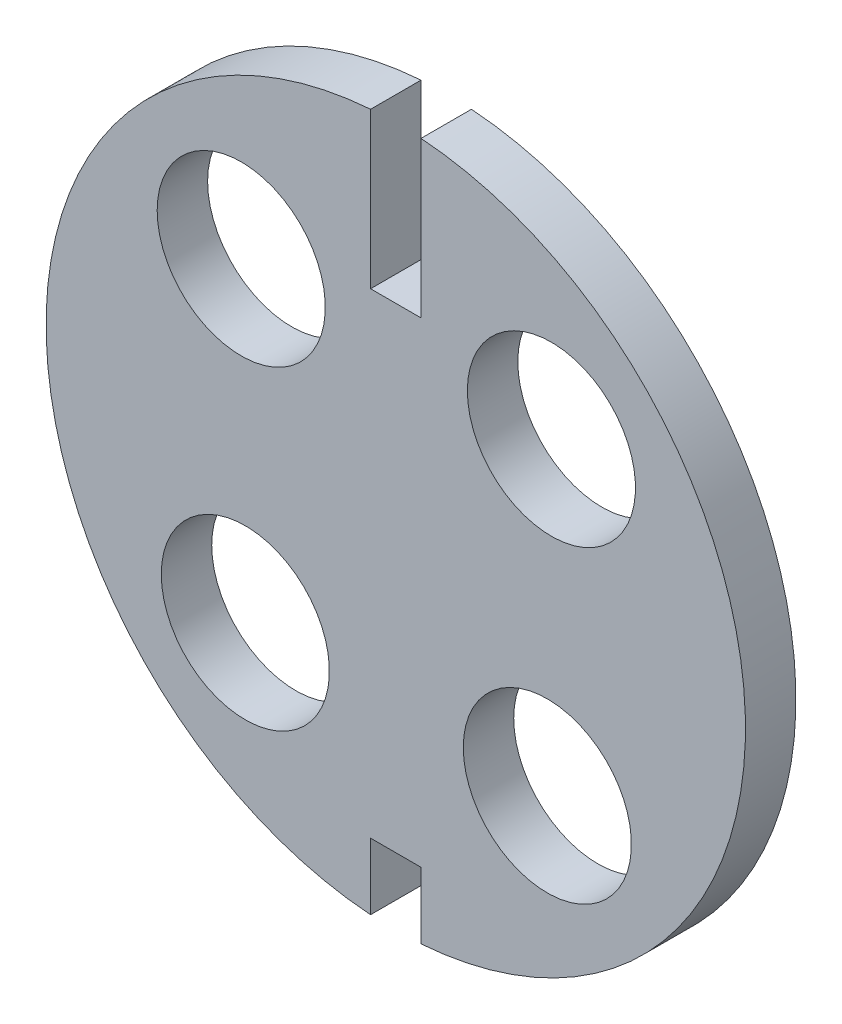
SolidWorks part; units mm, degrees
ref_plane "Front Plane" through (0, 0, 0) normal (0, 0, 1) x (1, 0, 0)
ref_plane "Top Plane" through (0, 0, 0) normal (0, 1, 0) x (1, 0, 0)
ref_plane "Right Plane" through (0, 0, 0) normal (1, 0, 0) x (0, 0, -1)
sketch "Sketch1" plane through (0, 0, 0) normal (0, 0, 1) x (1, 0, 0)
  circle A0 centre (0, 0) radius 26.416
  dimension "D1" = 52.832
extrude "Extrude1" add sketch "Sketch1" along normal blind 3.81
sketch "Sketch2" plane through (0, 0, 0) normal (0, 0, 1) x (1, 0, 0)
  line L0 (0, 0) -> (0, 27.8395) construction
  line L1 (0, 0) -> (0, -28.8472) construction
  line L2 (0, 0) -> (-23.3487, 23.3487) construction
  line L3 (0, 0) -> (-29.645, 0) construction
  line L4 (0, 0) -> (31.2407, 0) construction
  circle A0 centre (-11.6743, 11.6743) radius 6.35
  circle A1 centre (11.7569, 11.5912) radius 6.35
  circle A2 centre (11.4489, -11.8955) radius 6.35
  circle A3 centre (-11.3643, -11.9764) radius 6.35
  dimension "D2" = 12.7
  dimension "D4" = 12.7
  dimension "D5" = 12.7
  dimension "D6" = 12.7
  dimension "D1" = 45
  dimension "D3" = 16.51
  dimension "D7" = 16.51
  dimension "D8" = 16.51
  dimension "D9" = 16.51
extrude "Cut-Extrude1" cut sketch "Sketch2" along normal through all
sketch "Sketch3" plane through (0, 0, 0) normal (0, 0, 1) x (1, 0, 0)
  line L0 (0, 0) -> (0, 27.4196) construction
  line L1 (0, 0) -> (0, -27.9234) construction
  line L2 (-30.4848, 0) -> (29.645, 0) construction
  line L4 (-1.905, 27.4196) -> (1.905, 27.4196)
  line L5 (-1.905, 27.4196) -> (-1.905, 14.605)
  line L6 (-1.905, 14.605) -> (1.905, 14.605)
  line L7 (1.905, 27.4196) -> (1.905, 14.605)
  line L8 (1.905, -27.9234) -> (-1.905, -27.9234)
  line L9 (1.905, -27.9234) -> (1.905, -21.336)
  line L10 (1.905, -21.336) -> (-1.905, -21.336)
  line L11 (-1.905, -27.9234) -> (-1.905, -21.336)
  dimension "D1" = 3.81
  dimension "D2" = 3.81
  dimension "D3" = 1.905
  dimension "D4" = 1.905
  dimension "D5" = 21.336
  dimension "D6" = 14.605
extrude "Cut-Extrude2" cut sketch "Sketch3" along normal through all
